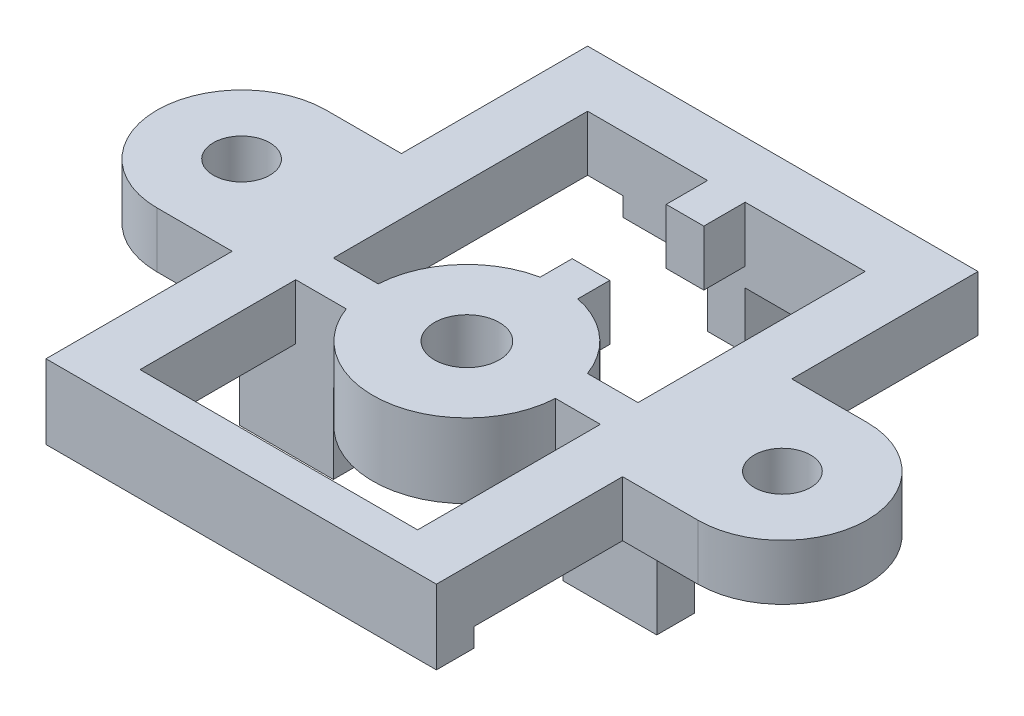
SolidWorks part; units mm, degrees
ref_plane "Front Plane" through (0, 0, 0) normal (0, 0, 1) x (1, 0, 0)
ref_plane "Top Plane" through (0, 0, 0) normal (0, 1, 0) x (1, 0, 0)
ref_plane "Right Plane" through (0, 0, 0) normal (1, 0, 0) x (0, 0, -1)
body saved out of another part "Stock-hemispherical_hot_cold_side_extended-1"
